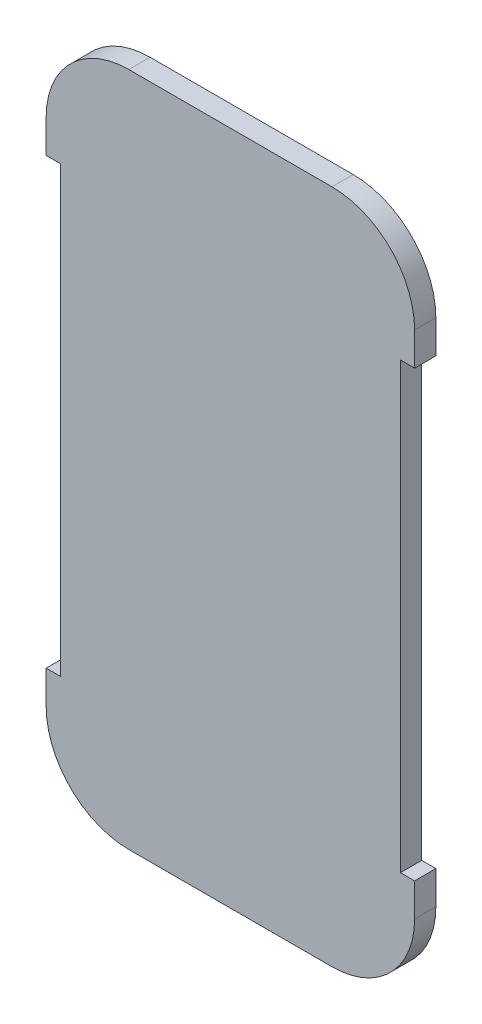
SolidWorks part; units mm, degrees
ref_plane "Front Plane" through (0, 0, 0) normal (0, 0, 1) x (1, 0, 0)
ref_plane "Top Plane" through (0, 0, 0) normal (0, 1, 0) x (1, 0, 0)
ref_plane "Right Plane" through (0, 0, 0) normal (1, 0, 0) x (0, 0, -1)
ref_plane "Plane1" through (0, 0, 4.2) normal (0, 0, -1) x (-1, 0, 0)
sketch "Sketch1" plane through (0, 0, 4.2) normal (0, 0, -1) x (-1, 0, 0)
  line L0 (-55.7, 309.3) -> (-64.3, 309.3)
  line L1 (-67.8, 305.8) -> (-67.8, 304.4)
  line L2 (-67.8, 304.4) -> (-67.2, 304.4)
  line L3 (-67.2, 304.4) -> (-67.2, 285.6)
  line L4 (-67.2, 285.6) -> (-67.8, 285.6)
  line L5 (-67.8, 285.6) -> (-67.8, 284.2)
  line L6 (-64.3, 280.7) -> (-55.7, 280.7)
  line L7 (-52.2, 284.2) -> (-52.2, 285.6)
  line L8 (-52.2, 285.6) -> (-52.8, 285.6)
  line L9 (-52.8, 285.6) -> (-52.8, 304.4)
  line L10 (-52.8, 304.4) -> (-52.2, 304.4)
  line L11 (-52.2, 304.4) -> (-52.2, 305.8)
  arc A0 (-64.3, 309.3) -> (-67.8, 305.8) centre (-64.3, 305.8) ccw
  arc A1 (-67.8, 284.2) -> (-64.3, 280.7) centre (-64.3, 284.2) ccw
  arc A2 (-55.7, 280.7) -> (-52.2, 284.2) centre (-55.7, 284.2) ccw
  arc A3 (-52.2, 305.8) -> (-55.7, 309.3) centre (-55.7, 305.8) ccw
extrude "Extrude1" add sketch "Sketch1" against normal blind 0.9
